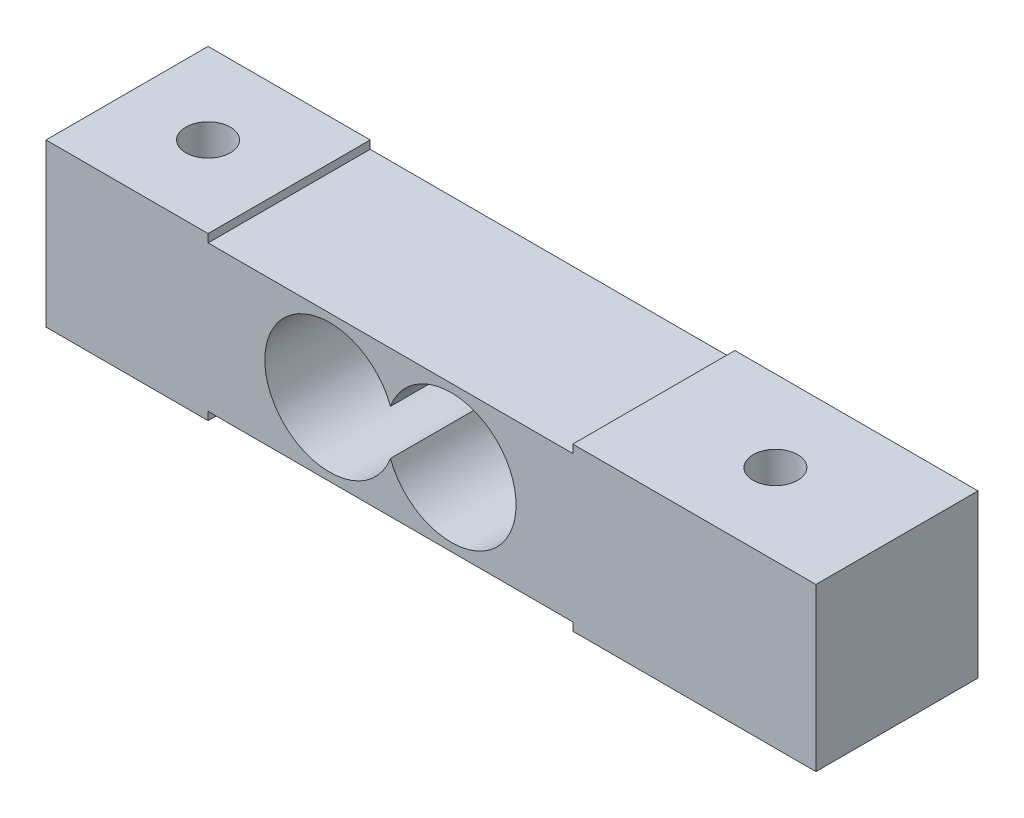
SolidWorks part; units mm, degrees
ref_plane "Face" through (0, 0, 0) normal (0, 0, 1) x (1, 0, 0)
ref_plane "Dessus" through (0, 0, 0) normal (0, 1, 0) x (1, 0, 0)
ref_plane "Droite" through (0, 0, 0) normal (1, 0, 0) x (0, 0, -1)
sketch "Esquisse1" plane through (0, 0, 0) normal (0, 0, 1) x (1, 0, 0)
  line L0 (20, 0) -> (20, -1)
  line L1 (0, 0) -> (20, 0)
  line L2 (0, 0) -> (0, -20)
  line L3 (0, -20) -> (20, -20)
  line L4 (95, 0) -> (95, -20)
  line L5 (65, 0) -> (65, -1)
  line L6 (20, -1) -> (65, -1)
  line L7 (20, -19) -> (65, -19)
  line L8 (20, -19) -> (20, -20)
  line L9 (65, 0) -> (95, 0)
  line L10 (65, -19) -> (65, -20)
  line L11 (65, -20) -> (95, -20)
  arc A0 (42.5, -7.2161) -> (42.5, -12.7839) centre (35, -10) ccw
  arc A1 (42.5, -12.7839) -> (42.5, -7.2161) centre (50, -10) ccw
  dimension "D8" = 16
  dimension "D10" = 15
  dimension "D1" = 95
  dimension "D2" = 20
  dimension "D3" = 20
  dimension "D4" = 30
  dimension "D5" = 1
  dimension "D6" = 1
  dimension "D7" = 10
  dimension "D9" = 15
extrude "Extrusion1" add sketch "Esquisse1" along normal blind 20
sketch "Esquisse2" plane through (0, 0, 0) normal (0, 1, 0) x (-1, 0, 0)
  line L0 (0, 20) -> (-20, 0) construction
  line L1 (0, 0) -> (-20, 20) construction
  circle A1 centre (-10, 10) radius 2.75
extrude "Enlèv. mat.-Extru.1" cut sketch "Esquisse2" against normal blind 20
sketch "Esquisse3" plane through (0, 0, 0) normal (0, 1, 0) x (-1, 0, 0)
  line L0 (-65, 0) -> (-95, 20) construction
  line L1 (-65, 20) -> (-95, 0) construction
  circle A0 centre (-80, 10) radius 2.75
extrude "Enlèv. mat.-Extru.2" cut sketch "Esquisse3" against normal blind 5
sketch "Esquisse4" plane through (0, -5, 0) normal (0, 1, 0) x (-1, 0, 0)
  circle A0 centre (-80, 10) radius 2.5
  circle A1 centre (-80, 10) radius 2.75 construction
extrude "Enlèv. mat.-Extru.3" cut sketch "Esquisse4" against normal through all
